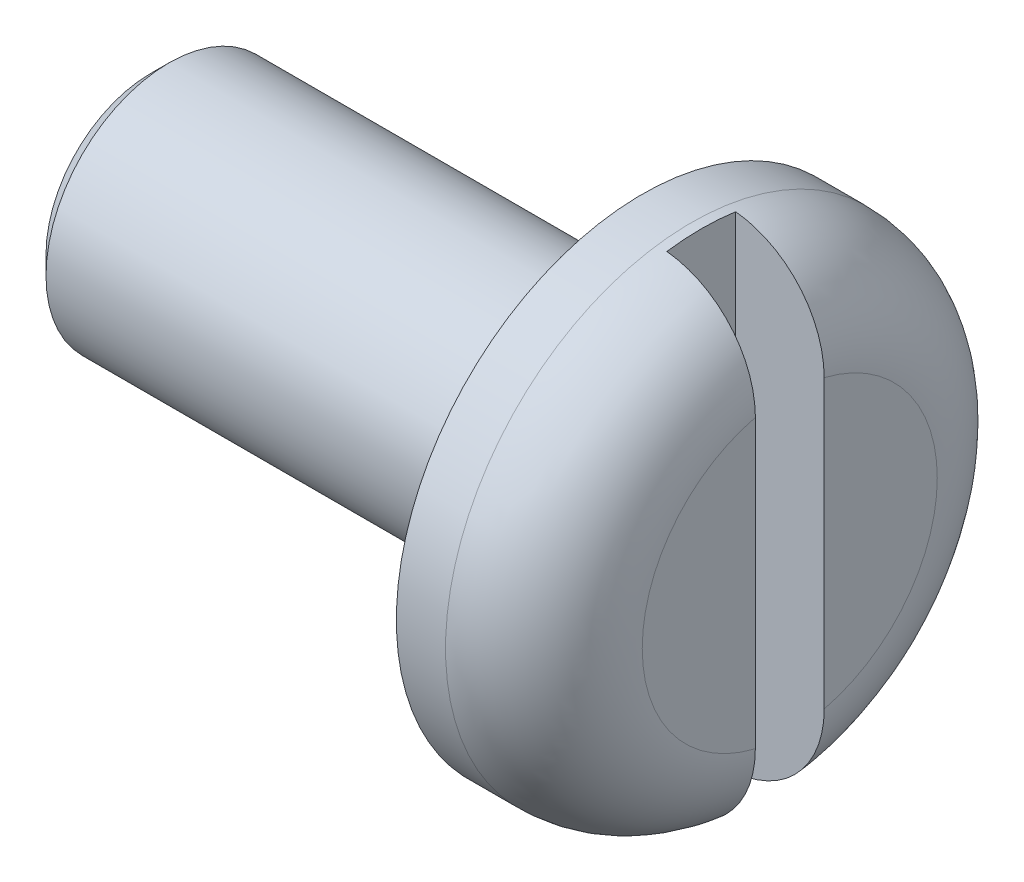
SolidWorks part; units mm, degrees
ref_plane "Front Plane" through (0, 0, 0) normal (0, 0, 1) x (1, 0, 0)
ref_plane "Top Plane" through (0, 0, 0) normal (0, 1, 0) x (1, 0, 0)
ref_plane "Right Plane" through (0, 0, 0) normal (1, 0, 0) x (0, 0, -1)
sketch "Sketch1" plane through (0, 0, 0) normal (1, 0, 0) x (0, 0, -1)
  circle A0 centre (0, 0) radius 10
  dimension "D1" = 20
extrude "Boss-Extrude1" add sketch "Sketch1" along normal blind 6
fillet "Fillet3" radius 4 1 edges at (6, 0, -10)
sketch "Sketch2" plane through (6, 0, 0) normal (1, 0, 0) x (0, 0, -1)
  line L1 (1.4, 11.1539) -> (-1.4, 11.1539)
  line L2 (1.4, 11.1539) -> (1.4, -11.1539)
  line L3 (1.4, -11.1539) -> (-1.4, -11.1539)
  line L4 (-1.4, 11.1539) -> (-1.4, -11.1539)
  line L5 (1.4, 11.1539) -> (-1.4, -11.1539) construction
  line L6 (1.4, -11.1539) -> (-1.4, 11.1539) construction
  point P0 (0, 0)
  dimension "D1" = 2.8
extrude "Cut-Extrude1" cut sketch "Sketch2" against normal blind 3.6
sketch "Sketch3" plane through (0, 0, 0) normal (-1, 0, 0) x (0, 0, 1)
  circle A0 centre (0, 0) radius 5
  dimension "D1" = 10
extrude "Boss-Extrude2" add sketch "Sketch3" along normal blind 20
sketch "Sketch4" plane through (-20, 0, 0) normal (-1, 0, 0) x (0, 0, 1)
  circle A0 centre (0, 0) radius 4.25
  dimension "D1" = 8.5
extrude "Cut-Extrude3" cut sketch "Sketch4" against normal blind 10 draft 45 flip side to cut
